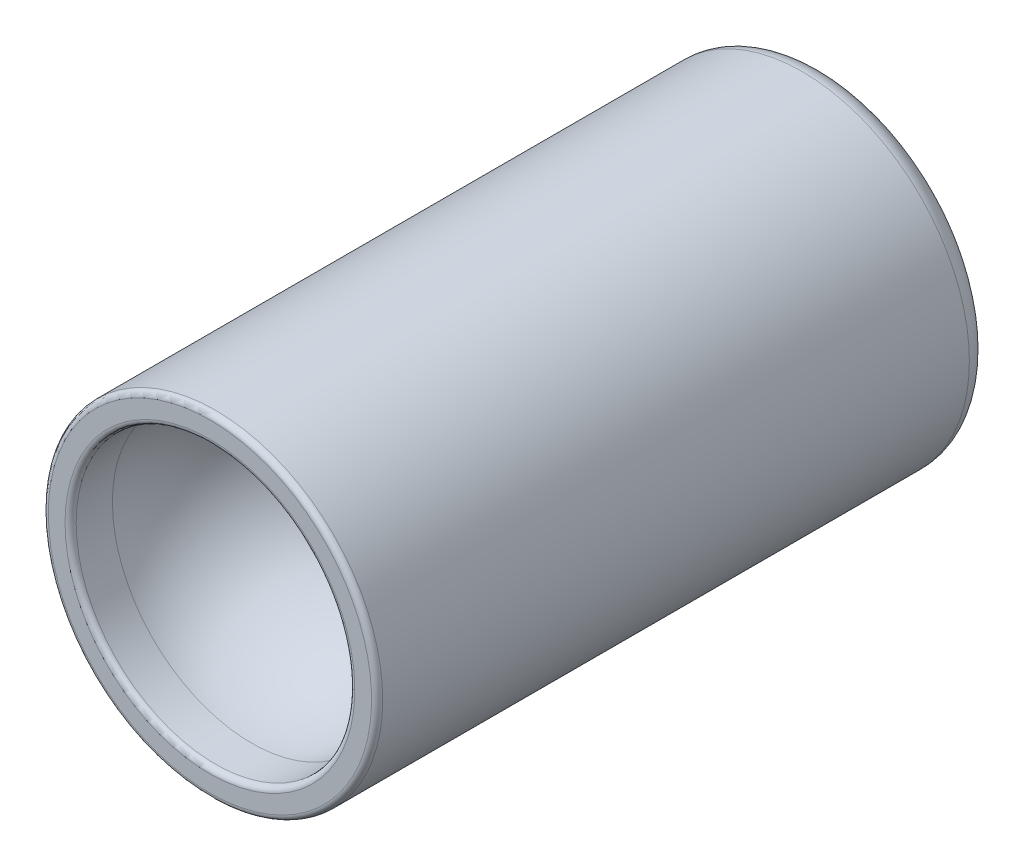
SolidWorks part; units mm, degrees
ref_plane "Plan de face" through (0, 0, 0) normal (0, 0, 1) x (1, 0, 0)
ref_plane "Plan de dessus" through (0, 0, 0) normal (0, 1, 0) x (1, 0, 0)
ref_plane "Plan de droite" through (0, 0, 0) normal (1, 0, 0) x (0, 0, -1)
sketch "Esquisse1" plane through (0, 0, 0) normal (1, 0, 0) x (0, 0, -1)
  line L0 (0, 0) -> (53.286, 0) construction
  line L1 (0, 6) -> (21.25, 6)
  line L2 (22, 5.25) -> (22, 5)
  line L3 (22, 5) -> (16.5, 5)
  line L4 (5.6758, 2.75) -> (12.3242, 2.75)
  line L5 (0, 6) -> (0, 5)
  line L6 (1.5, 5) -> (0, 5)
  arc A0 (5.6758, 2.75) -> (1.5, 5) centre (1.5, 0) ccw
  arc A1 (16.5, 5) -> (12.3242, 2.75) centre (16.5, 0) ccw
  arc A2 (21.25, 6) -> (22, 5.25) centre (21.25, 5.25) cw
  point P14 (22, 6)
  dimension "D2" = 5
  dimension "D5" = 1.5
  dimension "D6" = 10
  dimension "D8" = 0.75
  dimension "D1" = 12
  dimension "D3" = 5.5
  dimension "D4" = 22
  dimension "D7" = 15
revolve "Révolution1" add sketch "Esquisse1" angle 360 about L0
fillet "Congé1" radius 0.2 5 edges at (6, 0, 0) (5, 0, -22) (2.75, 0, -12.3242) (2.75, 0, -5.6758) (5, 0, 0)
